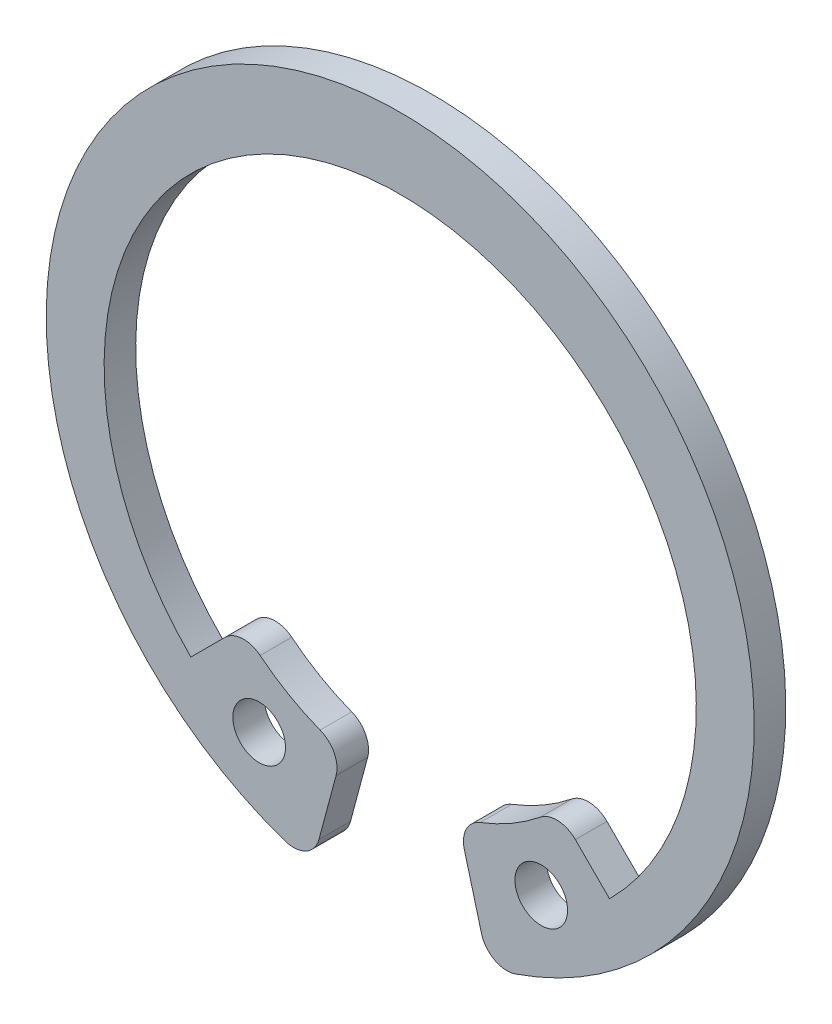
SolidWorks part; units mm, degrees
ref_plane "Plan1" through (0, 0, 0) normal (0, 0, 1) x (1, 0, 0)
ref_plane "Plan2" through (0, 0, 0) normal (0, 1, 0) x (1, 0, 0)
ref_plane "Plan3" through (0, 0, 0) normal (1, 0, 0) x (0, 0, -1)
sketch "Esquisse1" plane through (0, 0, 0) normal (0, 0, 1) x (1, 0, 0)
  line L0 (-2.9117, 10.8667) -> (2.0576, -7.6791) construction
  line L1 (0, 0) -> (0, -67.082) construction
  line L2 (3.0894, -11.5298) -> (2.4364, -9.0927)
  line L3 (0, 0) -> (7, -7) construction
  line L4 (6.6563, -6.6563) -> (7.955, -7.955)
  line L5 (-3.0894, -11.5298) -> (-2.4364, -9.0927)
  line L6 (-6.6563, -6.6563) -> (-7.955, -7.955)
  line L7 (0, 0) -> (0, 11.25) construction
  line L8 (0, 11.25) -> (0, 13.95) construction
  line L9 (-2.7629, -10.3113) -> (-7.955, -7.955) construction
  arc A0 (7.955, -7.955) -> (-7.955, -7.955) centre (0, 0) ccw
  arc A1 (-5.3208, -6.5856) -> (-3.0429, -7.9007) centre (0, 0) ccw
  arc A2 (4.3811, -12.2165) -> (-4.3811, -12.2165) centre (0, 0.5) ccw
  arc A4 (3.0429, -7.9007) -> (5.3208, -6.5856) centre (0, 0) ccw
  arc A5 (5.3208, -6.5856) -> (6.6563, -6.6563) centre (5.9492, -7.3634) cw
  arc A6 (2.4364, -9.0927) -> (3.0429, -7.9007) centre (3.4023, -8.8339) cw
  arc A7 (-2.4364, -9.0927) -> (-3.0429, -7.9007) centre (-3.4023, -8.8339) ccw
  arc A8 (-6.6563, -6.6563) -> (-5.3208, -6.5856) centre (-5.9492, -7.3634) cw
  arc A9 (-4.3811, -12.2165) -> (-3.0894, -11.5298) centre (-4.0553, -11.271) ccw
  arc A10 (4.3811, -12.2165) -> (3.0894, -11.5298) centre (4.0553, -11.271) cw
  circle A11 centre (-5.3589, -9.1331) radius 1
  circle A12 centre (5.3589, -9.1331) radius 1
  point P19 (5.9867, -5.9867)
  point P22 (2.1913, -8.1779)
  point P25 (-2.1913, -8.1779)
  point P30 (-5.9867, -5.9867)
  point P33 (-3.356, -12.5246)
  point P36 (3.356, -12.5246)
  dimension "D1" = 13.45
  dimension "D2" = 4.5
  dimension "D3" = 2.7
  dimension "D6" = 1
  dimension "D4" = 0.5
  dimension "D7" = 2
  dimension "a" = 15
  dimension "D5" = 30
extrude "Base-Extrusion" add sketch "Esquisse1" along normal blind 1.2
equation "\"D5@Esquisse1\"=\"a@Esquisse1\"*2"
equation "\"D6@Esquisse1\"=\"D7@Esquisse1\"/2"
equation "\"D4@Esquisse1\" = \"D6@Esquisse1\"/2"
